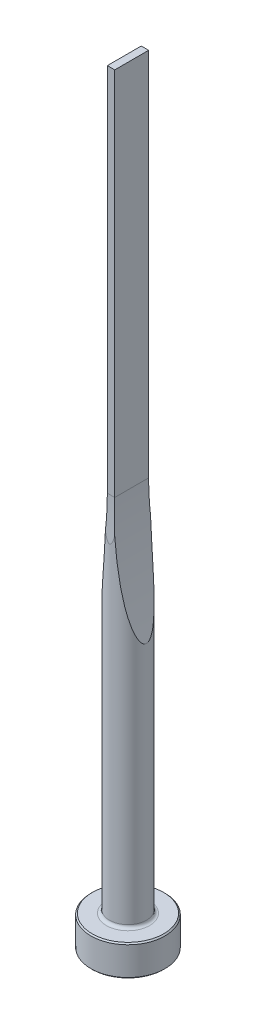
SolidWorks part; units mm, degrees
ref_plane "Front Plane" through (0, 0, 0) normal (0, 0, 1) x (1, 0, 0)
ref_plane "Top Plane" through (0, 0, 0) normal (0, 1, 0) x (1, 0, 0)
ref_plane "Right Plane" through (0, 0, 0) normal (1, 0, 0) x (0, 0, -1)
sketch "Sketch1" plane through (0, 0, 0) normal (0, 0, 1) x (1, 0, 0)
  line L0 (0, 0) -> (5.8, 0)
  line L1 (55, 0) -> (-55, 0) construction
  line L2 (6, 0.2) -> (6, 4.8)
  line L3 (5.8, 5) -> (3.5, 5)
  line L4 (3, 5.5) -> (3, 125)
  line L5 (0, 125) -> (3, 125)
  line L6 (6, 4.8) -> (5.8, 5)
  line L7 (5.8, 0) -> (6, 0.2)
  line L8 (0, 125) -> (0, 0)
  arc A0 (3, 5.5) -> (3.5, 5) centre (3.5, 5.5) ccw
  point P1 (6, 0)
  point P6 (6, 5)
  dimension "D4" = 0.5
  dimension "D1" = 3
  dimension "D2" = 6
  dimension "D3" = 5
  dimension "D5" = 125
revolve "Revolve1" add sketch "Sketch1" angle 360 about L8
sketch "Sketch2" plane through (0, 0, 0) normal (0, 0, 1) x (1, 0, 0)
  line L0 (0.6, 125) -> (0.6, 65)
  line L1 (3, 125) -> (-3, 125) construction
  line L2 (-0.6, 125) -> (-0.6, 65)
  line L3 (3, 125) -> (3, 44.3544)
  line L4 (-3, 125) -> (-3, 44.3544)
  line L5 (0, -6.6) -> (0, 6.6) construction
  line L6 (3, 125) -> (0.6, 125)
  line L8 (-0.6, 125) -> (-3, 125)
  arc A0 (0.6, 65) -> (3, 44.3544) centre (90.6, 65) ccw
  arc A1 (-0.6, 65) -> (-3, 44.3544) centre (-90.6, 65) cw
  dimension "D4" = 90
  dimension "D1" = 60
  dimension "D2" = 1.2
  dimension "D3" = 0.6
extrude "Cut-Extrude1" cut sketch "Sketch2" against normal mid plane 10
sketch "Sketch3" plane through (0, 0, 0) normal (1, 0, 0) x (0, 0, -1)
  line L0 (2.75, 125) -> (2.75, 65)
  line L1 (-2.9394, 125) -> (2.9394, 125) construction
  line L2 (-2.75, 125) -> (-2.75, 65)
  line L3 (3, 125) -> (3, 58.2965)
  line L4 (2.75, 125) -> (3, 125)
  line L5 (0, 6.6) -> (0, -6.6) construction
  line L6 (-3, 125) -> (-3, 58.2965)
  line L8 (-2.75, 125) -> (-3, 125)
  arc A0 (2.75, 65) -> (3, 58.2965) centre (92.75, 65) ccw
  arc A1 (-2.75, 65) -> (-3, 58.2965) centre (-92.75, 65) cw
  dimension "D2" = 90
  dimension "D1" = 60
  dimension "D3" = 5.5
  dimension "D4" = 2.75
extrude "Cut-Extrude2" cut sketch "Sketch3" against normal mid plane 10
